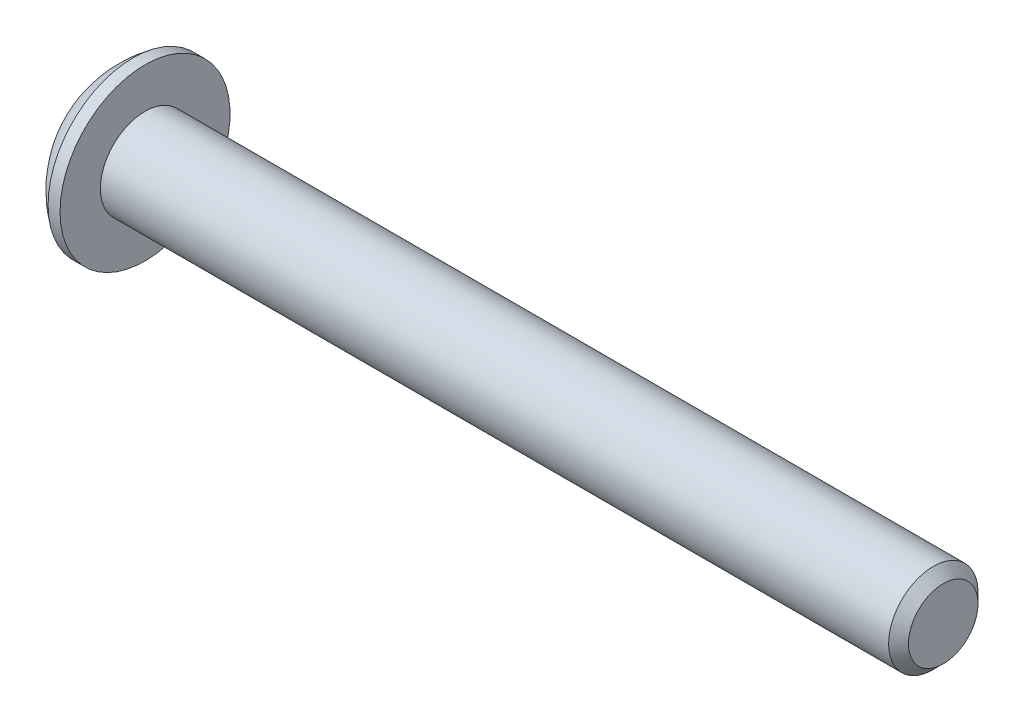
SolidWorks part; units mm, degrees
ref_plane "Plane1" through (0, 0, 0) normal (0, 0, 1) x (1, 0, 0)
ref_plane "Plane2" through (0, 0, 0) normal (0, 1, 0) x (1, 0, 0)
ref_plane "Plane3" through (0, 0, 0) normal (1, 0, 0) x (0, 0, -1)
revolve "BaseBody" add sketch "BodySke" angle 360 about L4
sketch "BodySke" plane through (0, 0, 0) normal (0, 0, 1) x (1, 0, 0)
  line L0 (26.8986, 0) -> (26.8986, 1.1062)
  line L1 (26.5824, 1.4224) -> (1.4986, 1.4224)
  line L2 (1.4986, 1.4224) -> (1.4986, 2.7051)
  line L3 (1.4986, 2.7051) -> (1.1176, 2.7051)
  line L4 (0, 0) -> (101.6, 0) construction
  line L5 (1.4986, -2.7051) -> (1.1176, -2.7051) construction
  line L6 (55.6768, -1.4224) -> (1.4986, -1.4224) construction
  line L7 (26.8986, 0) -> (0, 0)
  line L8 (0, 1.3526) -> (0, -1.3526) construction
  line L9 (0, 0) -> (0, 1.3526)
  line L10 (26.8986, 1.1062) -> (26.5824, 1.4224)
  line L11 (26.8986, -1.1062) -> (26.5824, -1.4224) construction
  line L12 (2.0269, 9.525) -> (2.0269, -1.4224) construction
  line L13 (1.4986, 9.525) -> (1.4986, -1.4224) construction
  arc A1 (0, 1.3526) -> (1.1176, 2.7051) centre (3.0141, 0) cw
  dimension "D1" = 2.7051
  dimension "Diameter" = 2.8448
  dimension "Length" = 25.4
  dimension "Head_dia" = 5.4102
  dimension "Head_ht" = 1.4986
  dimension "Head_side_ht" = 0.381
  dimension "Minor_dia" = 2.2123
  dimension "Body_ch_ang" = 45
  dimension "Advance" = 0.5283
  dimension "Thread_nom" = 25.4
sketch "Sketch2" plane through (0, 0, 0) normal (0, 0, 1) x (1, 0, 0)
  line L0 (0, 0.7874) -> (0.889, 0.7874)
  line L1 (0.889, 0.7874) -> (1.3436, 0)
  line L3 (1.3436, 0) -> (0, 0)
  line L4 (0, 0) -> (0, 0.7874)
  line L5 (0, -0.7874) -> (0.889, -0.7874) construction
  line L6 (0, 0) -> (47.625, 0) construction
  dimension "D2" = 60
  dimension "PreBroach_depth" = 0.889
  dimension "PreBroach_dia" = 1.5748
revolve "PreBroach" cut sketch "Sketch2" angle 360 about L6
sketch "Sketch3" plane through (0, 0, 0) normal (1, 0, 0) x (0, 0, -1)
  line L0 (-0.7874, -0.4546) -> (-0.7874, 0.4546)
  line L1 (-0.7874, 0.4546) -> (0, 0.9092)
  line L2 (0, 0.9092) -> (0.7874, 0.4546)
  line L3 (0.7874, 0.4546) -> (0.7874, -0.4546)
  line L4 (0.7874, -0.4546) -> (0, -0.9092)
  line L5 (0, -0.9092) -> (-0.7874, -0.4546)
  dimension "D1" = 0.7874
  dimension "D2" = 0.7874
  dimension "D3" = 1.5748
  dimension "Hex_size" = 1.5748
extrude "Hex" cut sketch "Sketch3" along normal blind 0.889
sketch "Sketch4" plane through (0, 9.525, 0) normal (1, 0, 0) x (0, 0, -1)
  line L0 (0, -9.525) -> (0.9398, -9.525)
  line L1 (0, -9.525) -> (6.1484, -5.9752) construction
  line L2 (0, -9.525) -> (0.4699, -8.7111)
  line L3 (0.7832, -9.3075) -> (0.8962, -9.2422)
  line L4 (0.58, -8.9555) -> (0.693, -8.8902)
  arc A0 (0.7832, -9.3075) -> (0.58, -8.9555) centre (0, -9.525) ccw
  arc A1 (0.9398, -9.525) -> (0.8962, -9.2422) centre (0, -9.525) ccw
  arc A2 (0.4699, -8.7111) -> (0.693, -8.8902) centre (0, -9.525) cw
  dimension "D1" = 30
  dimension "Spline_n_dim" = 1.6256
  dimension "Spline_m_dim" = 1.8796
  dimension "D2" = 60
  dimension "D3" = 0.2032
  dimension "Spline_p_dim" = 0.4064
extrude "Spline" cut sketch "Sketch4" along normal blind 0.889
pattern_circular "CirPattern1" count 6 every 60 about axis through (0, 0, 0) along (1, 0, 0) of "Spline"
sketch "ThdSchSke" plane through (0, 0, 0) normal (0, 0, 1) x (1, 0, 0)
  line L0 (2.0269, -1.1062) -> (1.8055, -1.4224)
  line L1 (2.0269, -1.1062) -> (2.2483, -1.4224)
  line L2 (2.2483, -1.4224) -> (2.2483, -1.778)
  line L3 (-3.175, 0) -> (5.1513, 0) construction
  line L4 (0, 0.4546) -> (0, 0.5719) construction
  line L5 (2.2483, -1.778) -> (1.8055, -1.778)
  line L6 (1.8055, -1.778) -> (1.8055, -1.4224)
  dimension "Thread_minor" = 2.2123
  dimension "Diameter" = 2.8448
  dimension "Start" = 2.0269
  dimension "SideAngle" = 55
  dimension "VeeAngle" = 70
  dimension "Overcut" = 3.556
revolve "ThreadSchematic" cut sketch "ThdSchSke" angle 360 about L3
pattern_linear "ThdSchPat"
equation "\"D1@BodySke\" = \"Head_dia@BodySke\" * .5"
equation "\"Thread_minor@ThreadCosmetic\" = \"Minor_dia@BodySke\""
equation "\"D1@Sketch3\" = \"Hex_size@Sketch3\" / 2"
equation "\"D2@Sketch3\" = \"D1@Sketch3\""
equation "\"D3@Sketch3\" = \"Hex_size@Sketch3\""
equation "\"D3@Sketch4\" = \"Spline_p_dim@Sketch4\" / 2"
equation "\"D1@Sketch4\" = \"D2@Sketch4\" / 2"
equation "\"Thread_length@ThreadCosmetic\" = ((sgn( (\"Length@BodySke\" - \"Advance@BodySke\" ) - \"Thread_nom@BodySke\" )-1)*( (\"Length@BodySke\" - \"Advance@BodySke\" ) - \"Thread_nom@BodySke\" ))/-2+ \"Thread_nom@BodySke\""
equation "\"Thread_minor@ThdSchSke\" = \"Minor_dia@BodySke\""
equation "\"Diameter@ThdSchSke\" = \"Diameter@BodySke\""
equation "\"Overcut@ThdSchSke\" = \"Diameter@BodySke\" * 1.25"
equation "\"Start@ThdSchSke\" = \"Head_ht@BodySke\" + \"Length@BodySke\" - \"Thread_length@ThreadCosmetic\"  '---Non-countersunk---"
equation "\"Num_threads@ThdSchPat\" = int( \"Thread_length@ThreadCosmetic\" / \"Advance@BodySke\" + 0.999 )  + 1"
equation "\"Advance@ThdSchPat\" = \"Thread_length@ThreadCosmetic\" /  (\"Num_threads@ThdSchPat\" - 1) 'relax it"
equation "\"Num_threads@ThdSchPat\" = \"Num_threads@ThdSchPat\" - sgn( \"Num_threads@ThdSchPat\" - 1) '---chamfered tips only---"
